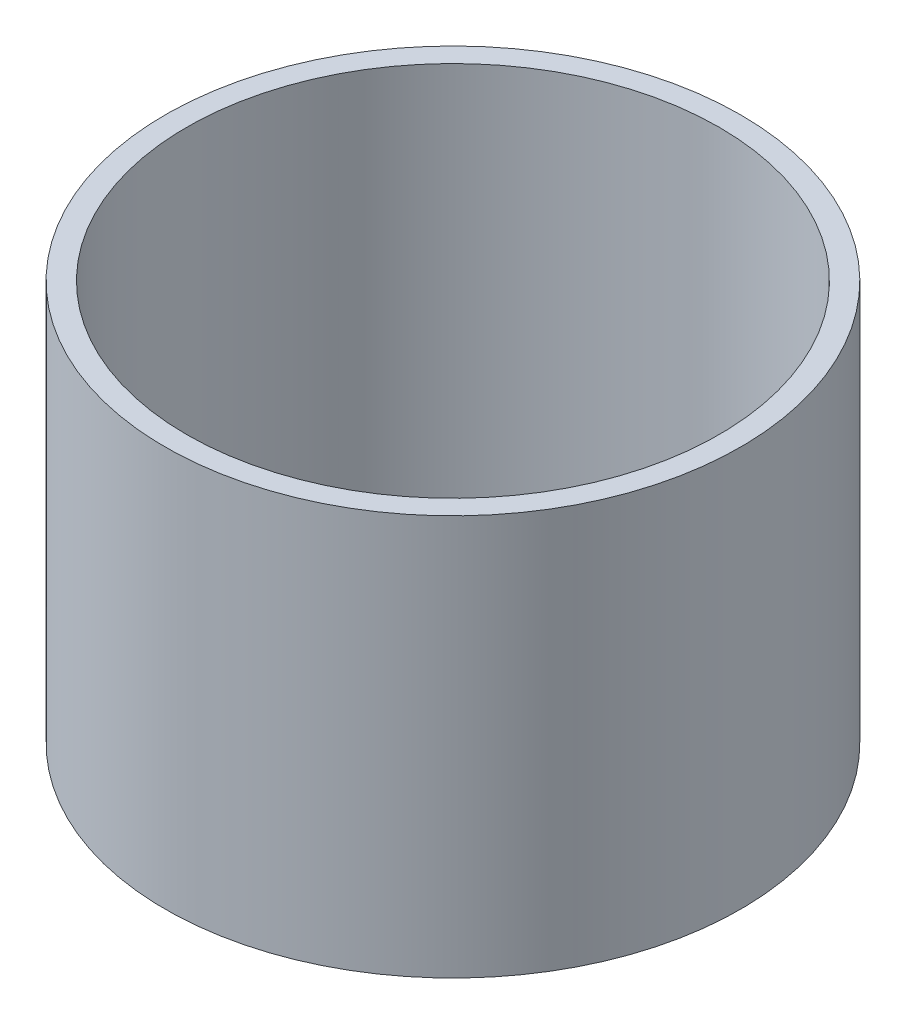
SolidWorks part; units mm, degrees
ref_plane "Front Plane" through (0, 0, 0) normal (0, 0, 1) x (1, 0, 0)
ref_plane "Top Plane" through (0, 0, 0) normal (0, 1, 0) x (1, 0, 0)
ref_plane "Right Plane" through (0, 0, 0) normal (1, 0, 0) x (0, 0, -1)
sketch "Sketch1" plane through (0, 0, 0) normal (0, 1, 0) x (1, 0, 0)
  circle A0 centre (0, 0) radius 109.5375
  circle A1 centre (0, 0) radius 101.3587
  dimension "D1" = 202.7174
  dimension "D2" = 219.075
extrude "Boss-Extrude1" add sketch "Sketch1" along normal blind 152.4
sketch "Sketch2" plane through (0, 0, 0) normal (0, -1, 0) x (1, 0, 0)
  circle A0 centre (0, 0) radius 101.3587
  circle A1 centre (0, 0) radius 100.0887
  circle A3 centre (0, 0) radius 101.3587 construction
  dimension "D1" = 1.27
extrude "Boss-Extrude2" [suppressed] add sketch "Sketch2" against normal blind 2.54
